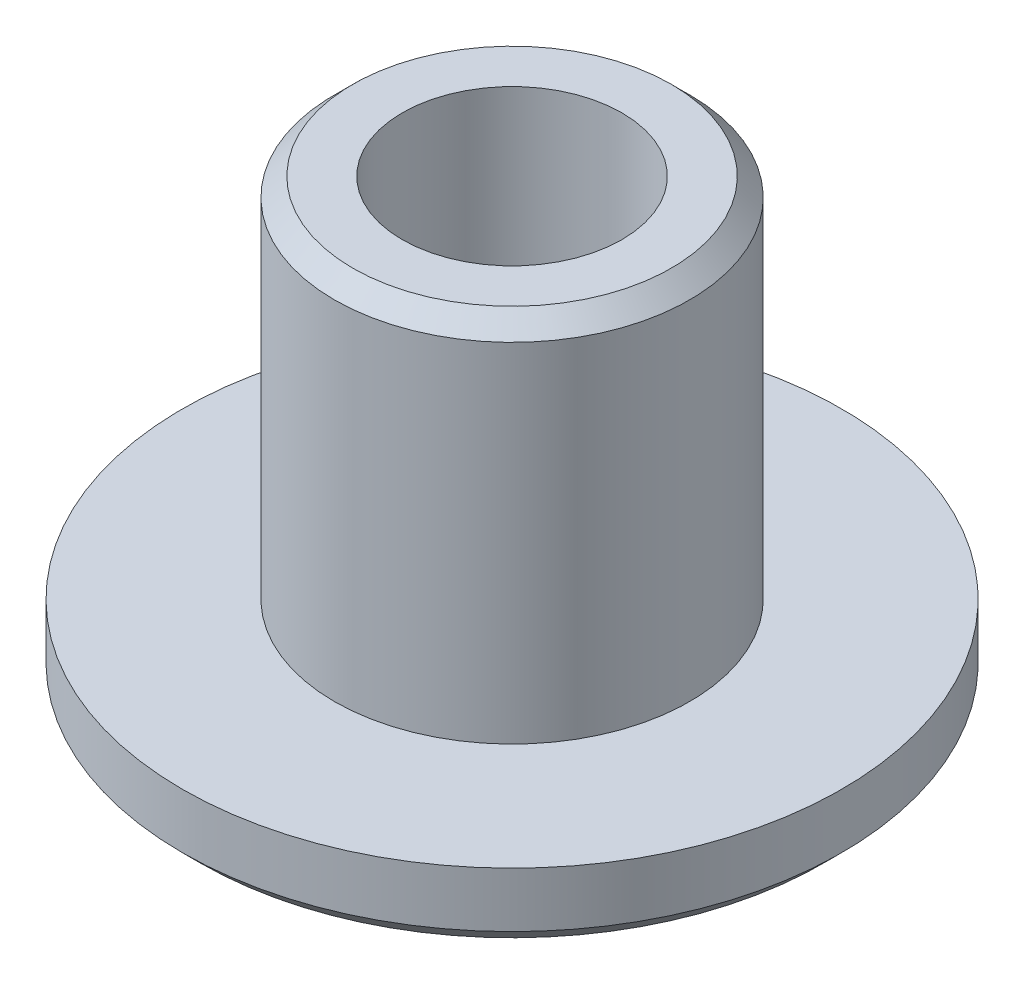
SolidWorks part; units mm, degrees
ref_plane "Ebene vorne" through (0, 0, 0) normal (0, 0, 1) x (1, 0, 0)
ref_plane "Ebene oben" through (0, 0, 0) normal (0, 1, 0) x (1, 0, 0)
ref_plane "Ebene rechts" through (0, 0, 0) normal (1, 0, 0) x (0, 0, -1)
sketch "Skizze1" plane through (0, 0, 0) normal (0, 1, 0) x (1, 0, 0)
  circle A0 centre (0, 0) radius 9
  circle A1 centre (0, 0) radius 3
  dimension "D1" = 18
  dimension "D2" = 6
extrude "Aufsatz-Linear austragen1" add sketch "Skizze1" along normal blind 2
sketch "Skizze2" plane through (0, 2, 0) normal (0, 1, 0) x (1, 0, 0)
  circle A0 centre (0, 0) radius 3 construction
  circle A1 centre (0, 0) radius 3
  circle A2 centre (0, 0) radius 4.85
  dimension "D1" = 9.7
extrude "Aufsatz-Linear austragen2" add sketch "Skizze2" along normal blind 10
chamfer "Fase1" distance 0.5 angle 45 2 edges at (0, 0, 9) (0, 12, 4.85)
